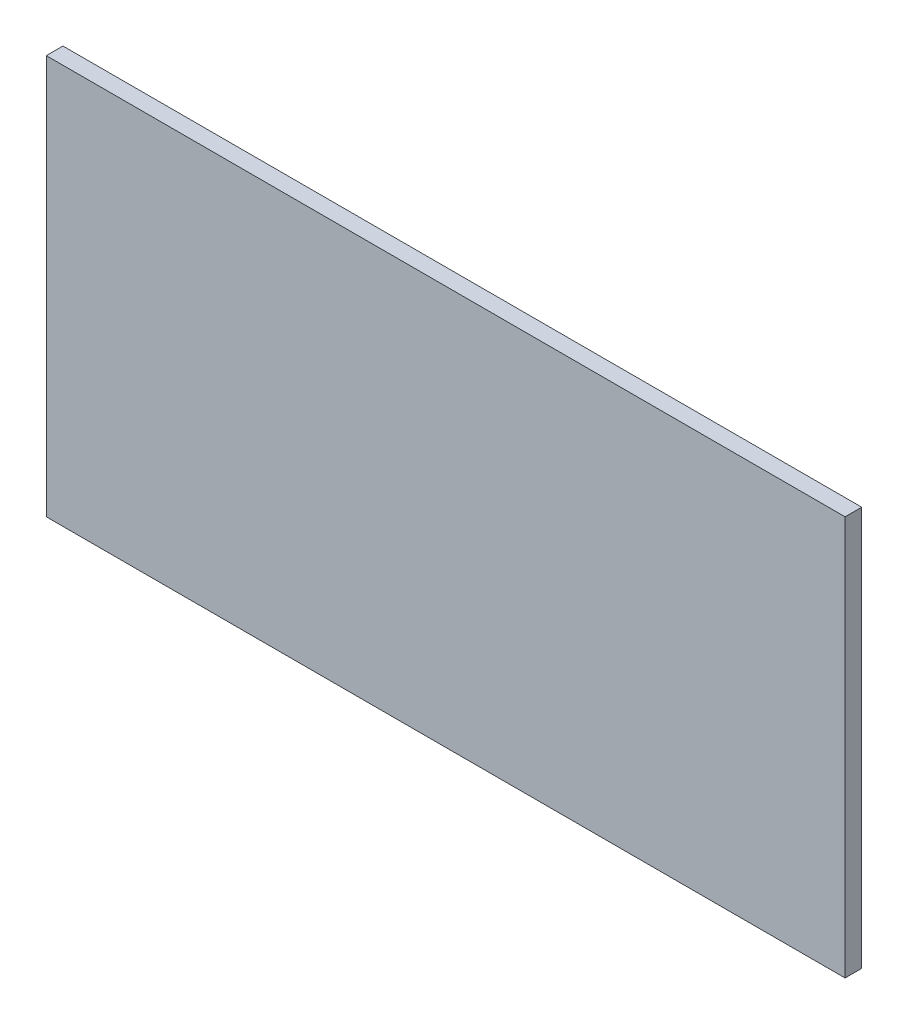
SolidWorks part; units mm, degrees
ref_plane "Front Plane" through (0, 0, 0) normal (0, 0, 1) x (1, 0, 0)
ref_plane "Top Plane" through (0, 0, 0) normal (0, 1, 0) x (1, 0, 0)
ref_plane "Right Plane" through (0, 0, 0) normal (1, 0, 0) x (0, 0, -1)
sketch "Sketch1" plane through (0, 0, 0) normal (0, 0, 1) x (1, 0, 0)
  line L1 (0, 0) -> (609.6, 0)
  line L2 (0, 0) -> (0, 304.8)
  line L3 (0, 304.8) -> (609.6, 304.8)
  line L4 (609.6, 0) -> (609.6, 304.8)
  dimension "D1" = 609.6
  dimension "D2" = 304.8
extrude "Extrude1" add sketch "Sketch1" along normal blind 12.7
